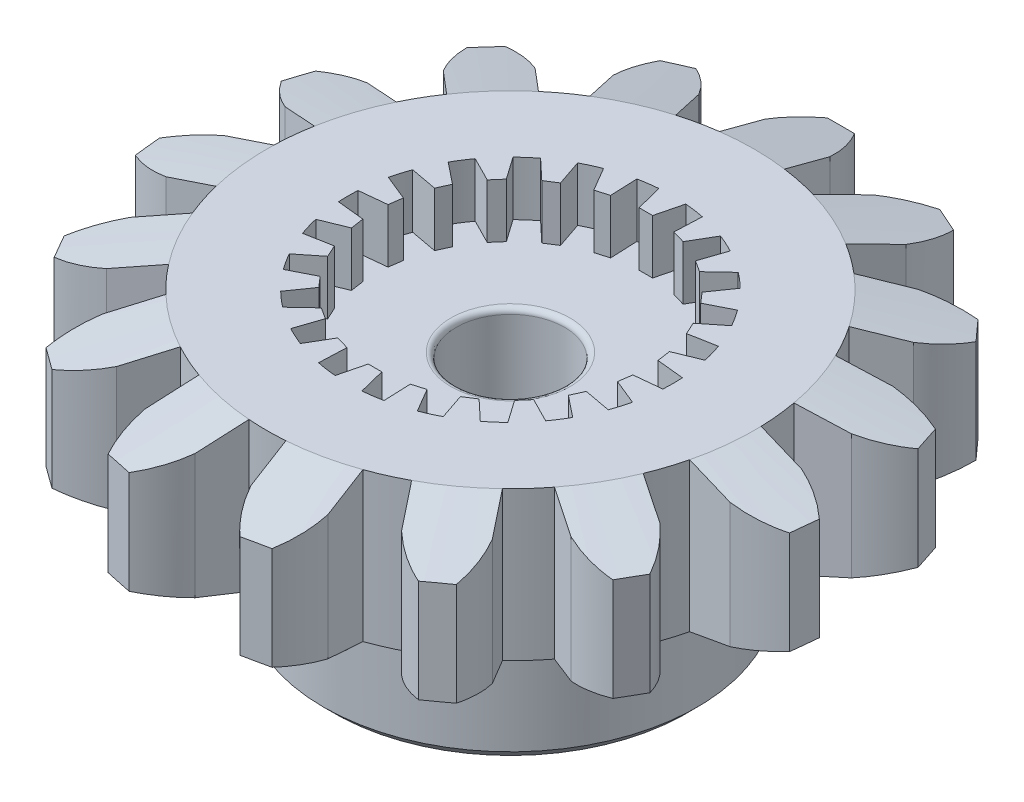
SolidWorks part; units mm, degrees
ref_plane "前视基准面" through (0, 0, 0) normal (0, 0, 1) x (1, 0, 0)
ref_plane "上视基准面" through (0, 0, 0) normal (0, 1, 0) x (1, 0, 0)
ref_plane "右视基准面" through (0, 0, 0) normal (1, 0, 0) x (0, 0, -1)
sketch "草图1" plane through (0, 0, 0) normal (0, 1, 0) x (1, 0, 0)
  circle A0 centre (0, 0) radius 9
  dimension "D1" = 18
extrude "凸台-拉伸1" add sketch "草图1" along normal blind 5.5
sketch "草图2" plane through (0, 5.5, 0) normal (0, 1, 0) x (1, 0, 0)
  circle A0 centre (0, 0) radius 6
  dimension "D1" = 12
extrude "切除-拉伸1" cut sketch "草图2" against normal blind 2
sketch "草图3" plane through (0, 5.5, 0) normal (0, 1, 0) x (1, 0, 0)
  line L0 (0, 9) -> (0, 12.2) construction
  line L1 (0.5, 12.2) -> (-0.5, 12.2)
  line L2 (0, 10.6) -> (-1.2, 10.6) construction
  line L3 (0, 9) -> (-1.2, 9) construction
  line L4 (-1.2, 10.6) -> (-1.2, 8.9196)
  line L5 (1.2, 10.6) -> (1.2, 8.9196)
  circle A0 centre (0, 0) radius 9 construction
  arc A1 (-0.5, 12.2) -> (-1.2, 10.6) centre (2.8071, 9.8) ccw
  arc A2 (1.2, 8.9196) -> (-1.2, 8.9196) centre (0, 0) ccw
  arc A3 (0.5, 12.2) -> (1.2, 10.6) centre (-2.8071, 9.8) cw
  dimension "D1" = 3.2
  dimension "D2" = 0.5
  dimension "D3" = 1.2
  dimension "D4" = 1.2
extrude "凸台-拉伸2" add sketch "草图3" against normal blind 5.5
pattern_circular "阵列(圆周)1" count 15 over 360 about axis through (0, 0, 0) along (0, 1, 0) of "凸台-拉伸2"
sketch "草图4" plane through (0, 5.5, 0) normal (0, 1, 0) x (1, 0, 0)
  line L0 (0, 6) -> (0, 5) construction
  line L1 (0.25, 5) -> (-0.25, 5)
  line L2 (0, 6) -> (-0.5, 6) construction
  line L3 (-0.4949, 5.9796) -> (-0.25, 5)
  line L4 (0.4949, 5.9796) -> (0.25, 5)
  circle A0 centre (0, 0) radius 6 construction
  circle A1 centre (0, 0) radius 6 construction
  arc A2 (0.4949, 5.9796) -> (-0.4949, 5.9796) centre (0, 0) ccw
  dimension "D1" = 1
  dimension "D2" = 0.25
  dimension "D3" = 0.5
extrude "凸台-拉伸3" add sketch "草图4" against normal blind 2
pattern_circular "阵列(圆周)2" count 22 over 360 about axis through (0, 0, 0) along (0, 1, 0) of "凸台-拉伸3"
sketch "草图5" plane through (0, 0, 0) normal (0, -1, 0) x (1, 0, 0)
  circle A0 centre (0, 0) radius 6.9
  dimension "D1" = 13.8
extrude "凸台-拉伸4" add sketch "草图5" along normal blind 4.8
sketch "草图6" plane through (0, -4.8, 0) normal (0, -1, 0) x (-1, 0, 0)
  line L0 (3, -4.3692) -> (3, 4.3692)
  line L1 (-3, -4.3692) -> (-3, 4.3692)
  arc A0 (3, -4.3692) -> (3, 4.3692) centre (0, 0) ccw
  arc A1 (-3, 4.3692) -> (-3, -4.3692) centre (0, 0) ccw
  dimension "D1" = 10.6
  dimension "D2" = 3
  dimension "D3" = 3
extrude "切除-拉伸2" cut sketch "草图6" against normal blind 5
fillet "圆角1" radius 0.2 4 edges at (3, -2.3, -4.3692) (3, -2.3, 4.3692) (-3, -2.3, 4.3692) (-3, -2.3, -4.3692)
sketch "草图7" plane through (0, -4.8, 0) normal (0, -1, 0) x (1, 0, 0)
  circle A0 centre (0, 0) radius 2
  dimension "D1" = 4
extrude "切除-拉伸3" cut sketch "草图7" against normal up to next
chamfer "倒角1" distance 0.4 angle 45 9 edges at (3.1137, -4.8, -4.1516) (5.3, -4.8, 0) (3.1137, -4.8, 4.1516) (3, -4.8, 0) (0, -4.8, -2) (-3.1137, -4.8, 4.1516) (-3, -4.8, 0) (-3.1137, -4.8, -4.1516) (-5.3, -4.8, 0)
chamfer "倒角2" distance 0.4 angle 45 1 edges at (0, -4.8, -6.9)
fillet "圆角2" radius 0.2 1 edges at (0, 3.5, 2)
sketch "草图9" plane through (0, 0, 0) normal (1, 0, 0) x (0, 0, -1)
  line L0 (14, 5.5) -> (9, 5.5)
  line L1 (7.7918, 5.5) -> (6.201, 5.5) construction
  line L2 (9, 5.5) -> (14, 4.1719)
  line L4 (14, 1.3281) -> (14, 0)
  line L5 (0, 0) -> (0, 5.5) construction
  line L6 (0.0854, 5.5) -> (-0.778, 5.5) construction
  line L7 (0, 2.75) -> (1.2676, 2.75) construction
  line L9 (9, 0) -> (14, 1.3281)
  line L10 (14, 0) -> (9, 0)
  line L11 (14, 5.5) -> (14, 4.1719)
  dimension "D3" = 14
revolve "切除-旋转2" cut sketch "草图9" angle 360 about L5
sketch "草图10" plane through (0, 0, 0) normal (0, 0, 1) x (1, 0, 0)
  circle A0 centre (0, -1.3) radius 1.2
  dimension "D2" = 2.4
  dimension "D1" = 1.3
extrude "切除-拉伸4" cut sketch "草图10" along normal up to next
